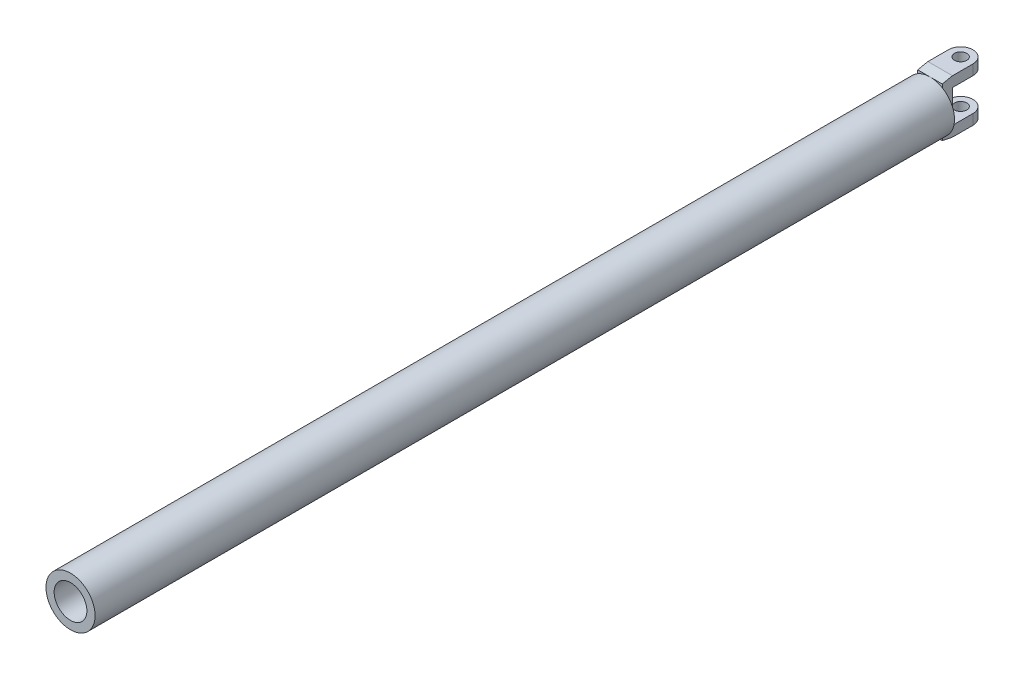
SolidWorks part; units mm, degrees
ref_plane "Front Plane" through (0, 0, 0) normal (0, 0, 1) x (1, 0, 0)
ref_plane "Top Plane" through (0, 0, 0) normal (0, 1, 0) x (1, 0, 0)
ref_plane "Right Plane" through (0, 0, 0) normal (1, 0, 0) x (0, 0, -1)
sketch "Sketch1" plane through (0, 0, 0) normal (0, 0, 1) x (1, 0, 0)
  circle A0 centre (0, 0) radius 60
  dimension "D1" = 120
extrude "Boss-Extrude1" add sketch "Sketch1" along normal blind 2100
sketch "Sketch2" plane through (0, 0, 0) normal (1, 0, 0) x (0, 0, -1)
  line L0 (0, -60) -> (0, 60)
  line L1 (0, -60) -> (0, 60) construction
  line L2 (0, 60) -> (25, 65)
  line L3 (25, 65) -> (105, 65)
  line L4 (105, 65) -> (105, 40)
  line L5 (105, 40) -> (27.4755, 40)
  line L6 (27.4755, 40) -> (25, 39.5049)
  line L7 (25, 39.5049) -> (25, -39.5049)
  line L8 (0, 0) -> (25, 0) construction
  line L9 (27.4755, -40) -> (25, -39.5049)
  line L10 (105, -40) -> (27.4755, -40)
  line L11 (105, -65) -> (105, -40)
  line L12 (25, -65) -> (105, -65)
  line L13 (0, -60) -> (25, -65)
  dimension "D1" = 25
  dimension "D2" = 25
  dimension "D3" = 25
  dimension "D4" = 40
  dimension "D5" = 105
  dimension "D6" = 80
extrude "Boss-Extrude2" add sketch "Sketch2" along normal mid plane 60
sketch "Sketch3" plane through (0, 0, 0) normal (0, 1, 0) x (1, 0, 0)
  line L0 (-30, 75) -> (30, 75) construction
  line L3 (30, 105) -> (-30, 105) construction
  line L4 (-30, 105) -> (-30, 25) construction
  line L5 (30, 105) -> (30, 25) construction
  circle A0 centre (0, 75) radius 15
  dimension "D1" = 30
  dimension "D2" = 30
extrude "Cut-Extrude1" cut sketch "Sketch3" against normal through all both and the other way through all
fillet "Fillet1" radius 30 4 edges at (-30, -52.5, -105) (30, -52.5, -105) (-30, 52.5, -105) (30, 52.5, -105)
sketch "Sketch4" plane through (0, 0, 2100) normal (0, 0, 1) x (1, 0, 0)
  circle A0 centre (0, 0) radius 40
  dimension "D1" = 80
extrude "Cut-Extrude2" cut sketch "Sketch4" against normal blind 500
